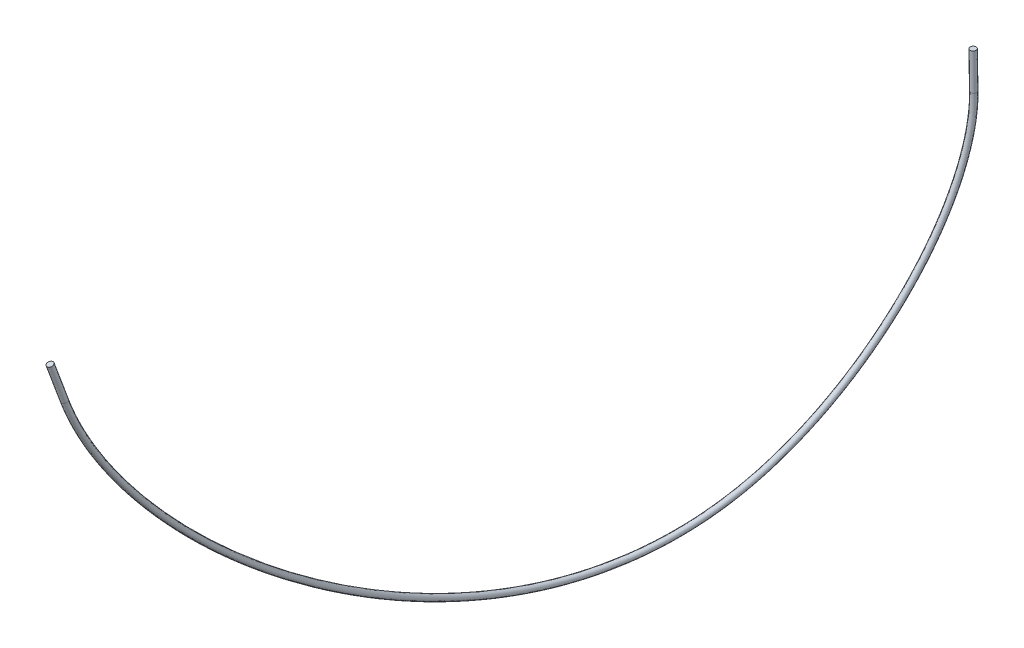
SolidWorks part; units mm, degrees
ref_plane "Front Plane" through (0, 0, 0) normal (0, 0, 1) x (1, 0, 0)
ref_plane "Top Plane" through (0, 0, 0) normal (0, 1, 0) x (1, 0, 0)
ref_plane "Right Plane" through (0, 0, 0) normal (1, 0, 0) x (0, 0, -1)
sketch3d "3DSketch1"
  line L0 (-11.2147, 131.3619, 293.6403) -> (-10.259, 121.8441, 290.6992) construction
  line L1 (32.5019, 124.0594, 87.1142) -> (32.5019, 114.0533, 86.9395) construction
  line L2 (-11.2147, 131.3619, 293.6403) -> (-10.259, 121.8441, 290.6992)
  line L3 (32.5019, 124.0594, 87.1142) -> (32.5019, 114.0533, 86.9395)
  spline S0 degree 3 poles (2124.7665, -9112.0501, -11268.5801) (-244.4765, 2295.1777, 1400.2478) (111.7179, -1879.2231, -251.7447) (36.8928, 1653.6458, 20.7883) (-1702.9849, -11310.0269, 9569.7318) knots -2.947158 -2.947158 -2.947158 -2.947158 0.651178 3.362332 3.362332 3.362332 3.362332 only from (-10.259, 121.8441, 290.6992) to (32.5019, 114.0533, 86.9395) construction
  spline S1 degree 3 poles (-10.259, 121.8441, 290.6992) (-5.7608, 77.0441, 276.8552) (18.784, -13.9841, 157.5036) (32.5019, 88.5907, 86.4951) (32.5019, 114.0533, 86.9395) knots 0 0 0 0 0.651178 1 1 1 1
ref_plane "Plane1" through (-11.2147, 131.3619, 293.6403) normal (0.0955, -0.9511, -0.2939) x (0.9954, 0.0912, 0.0282)
sketch "PipeSketch" plane through (-11.2147, 131.3619, 293.6403) normal (0.0955, -0.9511, -0.2939) x (0.9954, 0.0912, 0.0282)
  circle A0 centre (0, 0) radius 0.813
  dimension "OuterDiameter" = 1.626
sweep "Cable_1" add profiles "PipeSketch" path "3DSketch1"
